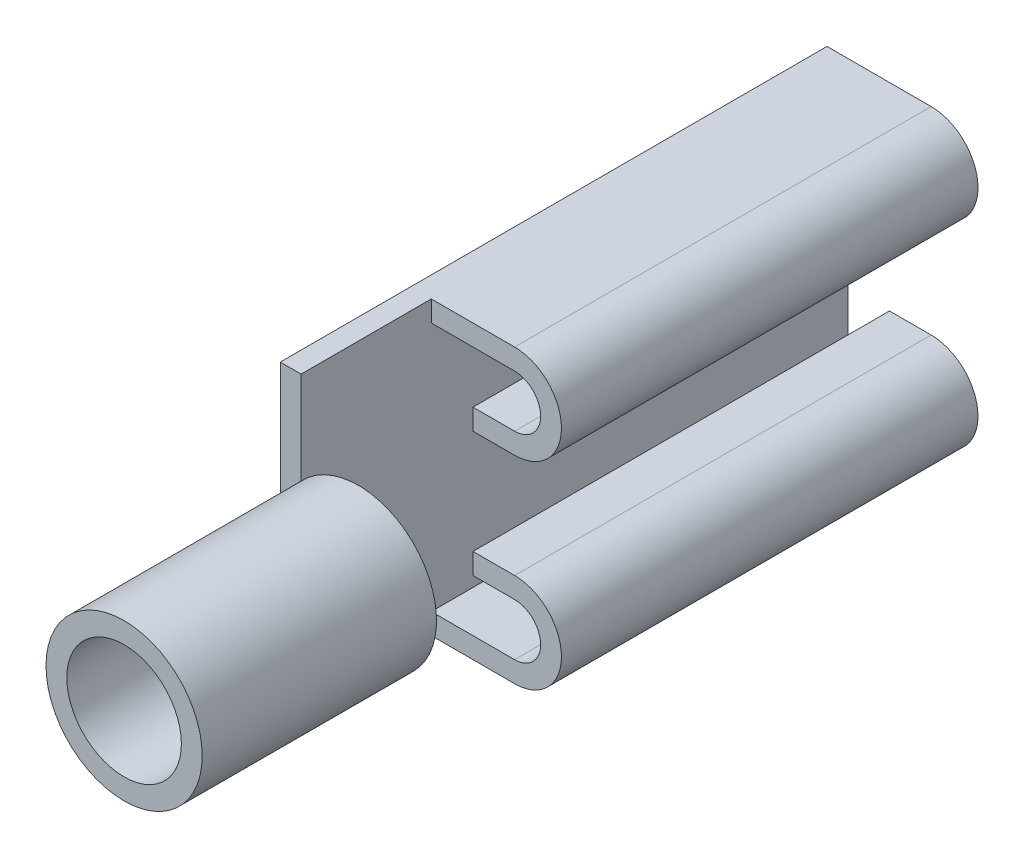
SolidWorks part; units mm, degrees
ref_plane "Front Plane" through (0, 0, 0) normal (0, 0, 1) x (1, 0, 0)
ref_plane "Top Plane" through (0, 0, 0) normal (0, 1, 0) x (1, 0, 0)
ref_plane "Right Plane" through (0, 0, 0) normal (1, 0, 0) x (0, 0, -1)
sketch "Sketch1" plane through (0, 0, 0) normal (0, 0, 1) x (1, 0, 0)
  line L0 (-0.8, 2.8) -> (1.2, 2.8)
  line L1 (-0.4, 2.4) -> (1.2, 2.4)
  line L2 (-0.4, 2.4) -> (-0.4, -2.4)
  line L3 (-0.4, -2.4) -> (1.2, -2.4)
  line L4 (1.2, -2.8) -> (-0.8, -2.8)
  line L6 (-0.8, 2.8) -> (-0.8, -2.8)
  line L8 (1.2, 1.4) -> (0.4, 1.4)
  line L9 (1.2, 1) -> (0.4, 1)
  line L10 (0.4, 1) -> (0.4, 1.4)
  line L12 (1.2, -1) -> (0.4, -1)
  line L13 (0.4, -1) -> (0.4, -1.4)
  line L14 (0.4, -1.4) -> (1.2, -1.4)
  arc A0 (1.2, 1) -> (1.2, 2.8) centre (1.2, 1.9) ccw
  arc A1 (1.2, 2.4) -> (1.2, 1.4) centre (1.2, 1.9) cw
  arc A2 (1.2, -1) -> (1.2, -2.8) centre (1.2, -1.9) cw
  arc A4 (1.2, -2.4) -> (1.2, -1.4) centre (1.2, -1.9) ccw
extrude "Boss-Extrude1" add sketch "Sketch1" along normal blind 8
sketch "Sketch3" plane through (0, 0, 8) normal (0, 0, 1) x (1, 0, 0)
  line L0 (-0.8, -2.8) -> (1.2, -2.8) construction
  line L1 (-0.8, 2.8) -> (-0.4, 2.8)
  line L2 (-0.8, 2.8) -> (-0.8, -2.8)
  line L3 (-0.8, -2.8) -> (-0.4, -2.8)
  line L4 (-0.4, 2.8) -> (-0.4, -2.8)
extrude "Boss-Extrude2" add sketch "Sketch3" along normal blind 2.5
sketch "Sketch4" plane through (0, 0, 10.5) normal (0, 0, 1) x (1, 0, 0)
  circle A0 centre (0.7, 0) radius 1.5
  circle A1 centre (0.7, 0) radius 1.1
extrude "Boss-Extrude3" add sketch "Sketch4" along normal blind 4.5
